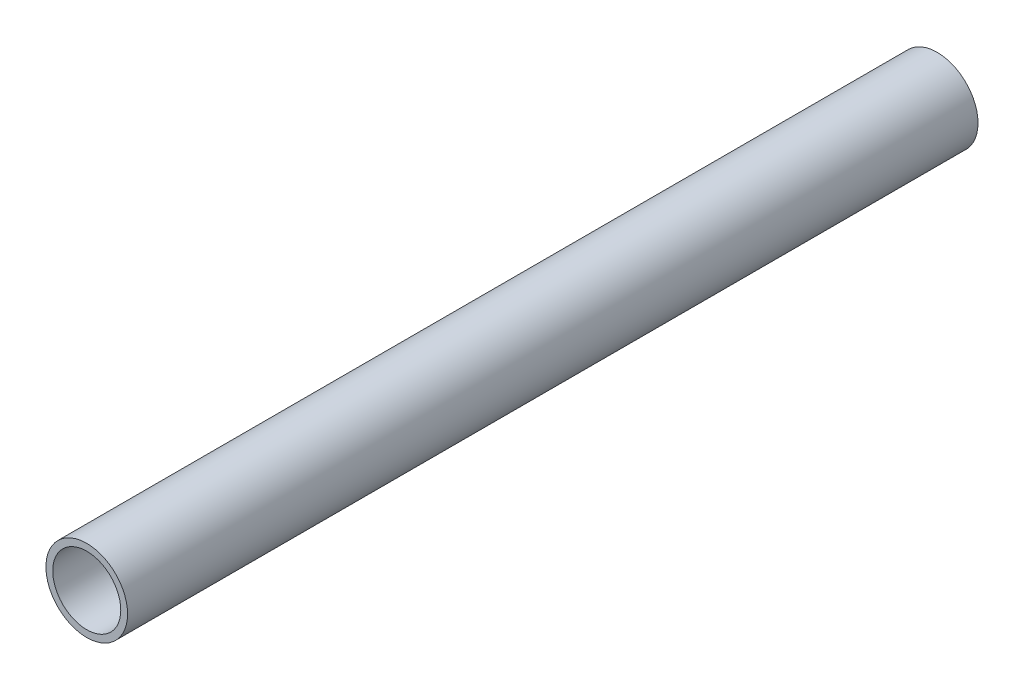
SolidWorks part; units mm, degrees
ref_plane "Plan de face" through (0, 0, 0) normal (0, 0, 1) x (1, 0, 0)
ref_plane "Plan de dessus" through (0, 0, 0) normal (0, 1, 0) x (1, 0, 0)
ref_plane "Plan de droite" through (0, 0, 0) normal (1, 0, 0) x (0, 0, -1)
sketch "Esquisse1" plane through (0, 0, 0) normal (0, 0, 1) x (1, 0, 0)
  circle A0 centre (0, 0) radius 25
  circle A1 centre (0, 0) radius 30
  dimension "D1" = 60
  dimension "D2" = 50
extrude "Extrusion1" add sketch "Esquisse1" along normal blind 625
